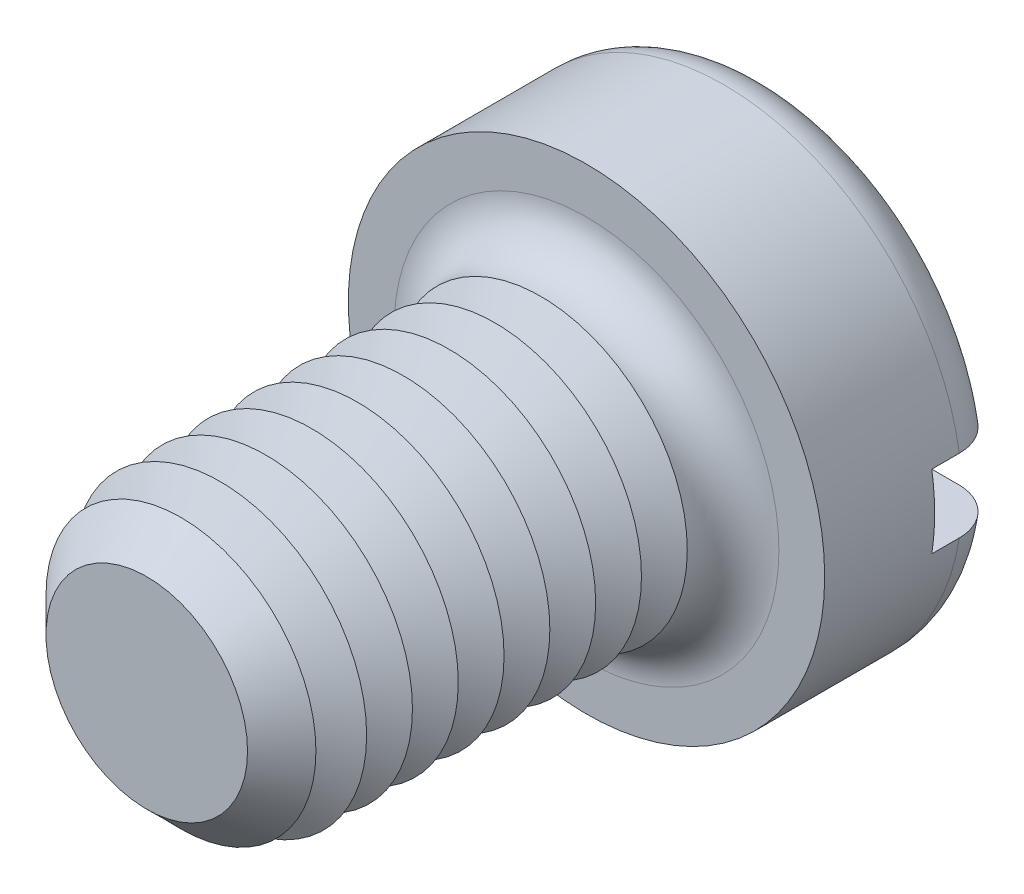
SolidWorks part; units mm, degrees
ref_plane "Front Plane" through (0, 0, 0) normal (0, 0, 1) x (1, 0, 0)
ref_plane "Top Plane" through (0, 0, 0) normal (0, 1, 0) x (1, 0, 0)
ref_plane "Right Plane" through (0, 0, 0) normal (1, 0, 0) x (0, 0, -1)
sketch "Sketch3" plane through (0, 0, 0) normal (0, 0, 1) x (1, 0, 0)
  circle A0 centre (0, 0) radius 6.5
  dimension "D1" = 13
extrude "Boss-Extrude2" add sketch "Sketch3" against normal blind 5
sketch "Sketch4" plane through (0, 0, 0) normal (0, 0, 1) x (1, 0, 0)
  circle A0 centre (0, 0) radius 4
  dimension "D1" = 8
extrude "Boss-Extrude3" add sketch "Sketch4" along normal blind 12
fillet "Fillet1" radius 1.25 2 edges at (6.5, 0, -5) (4, 0, 0)
chamfer "Chamfer1" distance 1.25 angle 45 1 edges at (4, 0, 12)
sketch "Sketch5" plane through (0, 0, 0) normal (1, 0, 0) x (0, 0, -1)
  line L0 (1.6944, 0) -> (-7.6738, 0) construction
sketch "Sketch6" plane through (0, 0, 0) normal (1, 0, 0) x (0, 0, -1)
  line L0 (-1.25, 4) -> (-1.875, 2.9175)
  line L1 (-1.875, 2.9175) -> (-2.5, 4)
  line L2 (-1.25, 4) -> (-10.75, 4) construction
  line L3 (-2.5, 4) -> (-1.25, 4)
  dimension "D1" = 1.25
revolve "Cut-Revolve1" cut sketch "Sketch6" angle 360 about L0
pattern_linear "LPattern1" count 8 spacing 1.25 along (0, 0, 1) of "Cut-Revolve1"
sketch "Sketch8" plane through (0, 0, -5) normal (0, 0, -1) x (-1, 0, 0)
  line L1 (6.5, -1) -> (-6.5, -1)
  line L2 (6.5, -1) -> (6.5, 1)
  line L3 (6.5, 1) -> (-6.5, 1)
  line L4 (-6.5, -1) -> (-6.5, 1)
  line L5 (6.5, -1) -> (-6.5, 1) construction
  line L6 (6.5, 1) -> (-6.5, -1) construction
  point P0 (0, 0)
  dimension "D1" = 13
  dimension "D2" = 2
extrude "Cut-Extrude1" cut sketch "Sketch8" against normal blind 2
